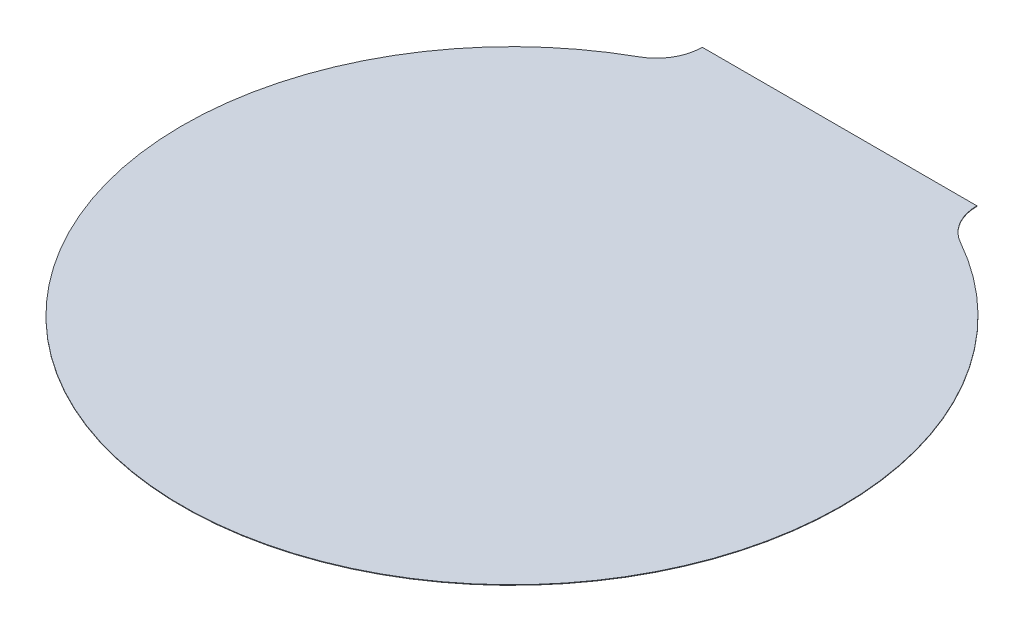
SolidWorks part; units mm, degrees
ref_plane "Front" through (0, 0, 0) normal (0, 0, 1) x (1, 0, 0)
ref_plane "Top" through (0, 0, 0) normal (0, 1, 0) x (1, 0, 0)
ref_plane "Right" through (0, 0, 0) normal (1, 0, 0) x (0, 0, -1)
sketch "Sketch1" plane through (0, 0, 0) normal (0, 1, 0) x (1, 0, 0)
  line L0 (3.8097, 9.0911) -> (-3.8097, 9.0911)
  arc A0 (-4.4602, 7.9824) -> (4.4602, 7.9824) centre (0, 0) ccw
  arc A1 (-4.4602, 7.9824) -> (-3.8097, 9.0911) centre (-5.0797, 9.0911) ccw
  arc A2 (3.8097, 9.0911) -> (4.4602, 7.9824) centre (5.0797, 9.0911) ccw
extrude "Extrude1" add sketch "Sketch1" along normal blind 0.015
